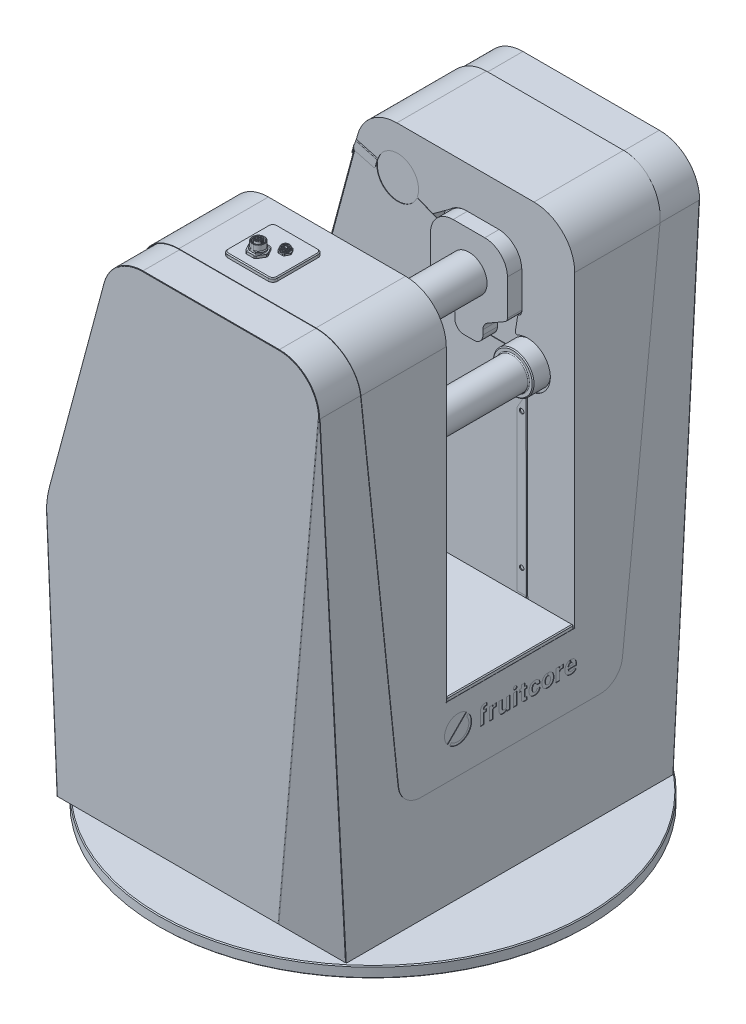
SolidWorks part; units mm, degrees
ref_plane "Ebene vorne" through (0, 0, 0) normal (0, 0, 1) x (1, 0, 0)
ref_plane "Ebene oben" through (0, 0, 0) normal (0, 1, 0) x (1, 0, 0)
ref_plane "Ebene rechts" through (0, 0, 0) normal (1, 0, 0) x (0, 0, -1)
imported_body "P001170-2-solid1"
imported_body "P001140-1-solid1"
imported_body "P001139-2-solid1"
imported_body "P001142-1-solid1"
imported_body "P001135-1-solid1"
imported_body "P000354-1-solid1"
imported_body "P000354-1-surface1"
imported_body "P000354-1-surface2"
imported_body "P000354-1-surface3"
imported_body "P000354-1-surface4"
imported_body "P000354-1-surface5"
imported_body "P000354-1-surface6"
imported_body "P000354-1-surface7"
imported_body "P000354-1-surface8"
imported_body "P000354-1-surface9"
imported_body "P000354-1-surface10"
imported_body "P000354-1-surface11"
imported_body "P000354-1-surface12"
imported_body "P000354-1-surface13"
imported_body "P000354-1-surface14"
imported_body "P000354-1-surface15"
imported_body "P000354-1-surface16"
imported_body "P000354-1-surface17"
imported_body "P000354-1-surface18"
imported_body "P000354-1-surface19"
imported_body "P000354-1-surface20"
imported_body "P000354-1-surface21"
imported_body "P000354-1-surface22"
imported_body "P000354-1-surface23"
imported_body "P000354-1-surface24"
imported_body "P000354-1-surface25"
imported_body "P000354-1-surface26"
imported_body "P000260-1-solid1"
imported_body "P001551-1/P001605-1-solid1"
imported_body "P001551-1/P001607-1-solid1"
imported_body "P001551-1/P004317-1-solid1"
imported_body "P001555-1/P001615-1-solid1"
imported_body "P001555-1/P001614-1-solid1"
imported_body "P001556-1/P001616-1-solid1"
imported_body "P001556-1/P001613-1-solid1"
imported_body "P001559-1/P001608-1-solid1"
imported_body "P001559-1/P001610-1-solid1"
imported_body "P001559-1/P004317-1-solid1"
imported_body "P003157-1/P000298-3-solid1"
imported_body "P003157-1/P000297-1-solid1"
sketch "Skizze1" plane through (0, -505, 0) normal (0, -1, 0) x (1, 0, 0)
  circle A0 centre (-50, 0) radius 236
extrude "Aufsatz-Linear austragen1" add sketch "Skizze1" against normal blind 12
sketch "Skizze2" plane through (-202, 0, 0) normal (-1, 0, 0) x (0, 0, 1)
  circle A0 centre (-98.88, -353) radius 5.3803
  circle A1 centre (101.38, -353.003) radius 12.754
  circle A2 centre (98.88, -353.003) radius 2.5 construction
extrude "Aufsatz-Linear austragen2" add sketch "Skizze2" against normal blind 1
sketch "Skizze3" plane through (-142.7679, 38.2546, 0) normal (-0.9659, 0.2588, 0) x (0, 0, 1)
  circle A0 centre (-132.9355, -178.0529) radius 12.0058
  circle A1 centre (-135.4355, -178.0529) radius 2.5 construction
  circle A2 centre (-147.0281, -26.0522) radius 11.3949
  circle A3 centre (-149.5281, -26.0522) radius 2.5 construction
  circle A4 centre (149.6, -28.5589) radius 6.1678
  circle A5 centre (149.6, -26.0589) radius 2.5 construction
  circle A6 centre (135.4355, -180.5529) radius 7.5783
  circle A7 centre (135.4355, -178.0529) radius 2.5 construction
extrude "Aufsatz-Linear austragen3" add sketch "Skizze3" against normal blind 1
sketch "Skizze4" plane through (0, 89, 0) normal (0, 1, 0) x (1, 0, 0)
  circle A0 centre (44.159, 155.5) radius 9.3234
  circle A1 centre (46.659, 155.5) radius 2.5 construction
  circle A2 centre (-83.341, 158) radius 9.1045
  circle A3 centre (-83.341, 155.5) radius 2.5 construction
extrude "Aufsatz-Linear austragen4" add sketch "Skizze4" against normal blind 1
sketch "Skizze5" plane through (0, 93, 0) normal (0, 1, 0) x (1, 0, 0)
  circle A0 centre (-16.5, -104.2523) radius 5.915
  circle A1 centre (-56.5, -104.2523) radius 5.7537
  circle A2 centre (-56.5, -144.2523) radius 4.5923
  circle A3 centre (-16.5, -144.2523) radius 5.7993
extrude "Aufsatz-Linear austragen5" add sketch "Skizze5" against normal blind 5
sketch "Skizze6" plane through (102, 0, 0) normal (1, 0, 0) x (0, 0, -1)
  circle A0 centre (-144.705, -4.9321) radius 7.4602
  circle A1 centre (144.8, -8) radius 6.7225
  circle A2 centre (144.8, -5.5) radius 2.5 construction
  circle A3 centre (-98.8792, -353.5) radius 13.682
  circle A4 centre (98.8792, -353.5) radius 7.7459
extrude "Aufsatz-Linear austragen6" add sketch "Skizze6" against normal blind 5
sketch "Skizze7" plane through (101, 0, 0) normal (1, 0, 0) x (0, 0, -1)
  circle A0 centre (0, -475.7107) radius 12.9578
extrude "Aufsatz-Linear austragen7" add sketch "Skizze7" against normal blind 5
sketch "Skizze8" plane through (-201, 0, 0) normal (-1, 0, 0) x (0, 0, 1)
  circle A0 centre (0, -474.8475) radius 13.4445
extrude "Aufsatz-Linear austragen8" add sketch "Skizze8" against normal blind 5
sketch "Skizze9" plane through (0, -292.5, 0) normal (0, 1, 0) x (1, 0, 0)
  line L1 (90.8349, 57.0472) -> (-170.5739, 57.0472)
  line L2 (90.8349, 57.0472) -> (90.8349, -56.9419)
  line L3 (90.8349, -56.9419) -> (-170.5739, -56.9419)
  line L4 (-170.5739, 57.0472) -> (-170.5739, -56.9419)
extrude "Aufsatz-Linear austragen9" add sketch "Skizze9" against normal blind 5
sketch "Skizze10" plane through (0, -281.7, 0) normal (0, 1, 0) x (1, 0, 0)
  circle A0 centre (-31.6152, 18.3848) radius 5.1454
  circle A1 centre (-32.2136, -18.335) radius 5.5152
  circle A3 centre (-68.3848, 18.3848) radius 4.59
  circle A4 centre (-68.3848, -18.3848) radius 5.0451
  circle A5 centre (-68.3848, 18.3848) radius 4.59 construction
extrude "Aufsatz-Linear austragen10" add sketch "Skizze10" against normal blind 5
sketch "Skizze11" plane through (0, 0, -71.5) normal (0, 0, -1) x (-1, 0, 0)
  circle A0 centre (93.64, 37.22) radius 30.8042
  circle A1 centre (0, 0) radius 30
  dimension "D1" = 60
extrude "Aufsatz-Linear austragen11" add sketch "Skizze11" along normal blind 1
sketch "Skizze12" plane through (0, 0, -71.5) normal (0, 0, 1) x (1, 0, 0)
  circle A0 centre (0, 0) radius 20
  circle A1 centre (50.034, -69.7655) radius 17.5
  dimension "D1" = 40
  dimension "D2" = 35
extrude "Aufsatz-Linear austragen12" add sketch "Skizze12" along normal blind 150
sketch "Skizze13" plane through (0, 0, -71.5) normal (0, 0, 1) x (1, 0, 0)
  circle A0 centre (0, 0) radius 29
  dimension "D1" = 58
extrude "Aufsatz-Linear austragen13" add sketch "Skizze13" along normal up to surface (15.43 mm away)
sketch "Skizze14" plane through (0, 0, 71.5) normal (0, 0, 1) x (1, 0, 0)
  circle A0 centre (-93.64, 37.22) radius 31.0421
extrude "Aufsatz-Linear austragen14" add sketch "Skizze14" along normal blind 1
